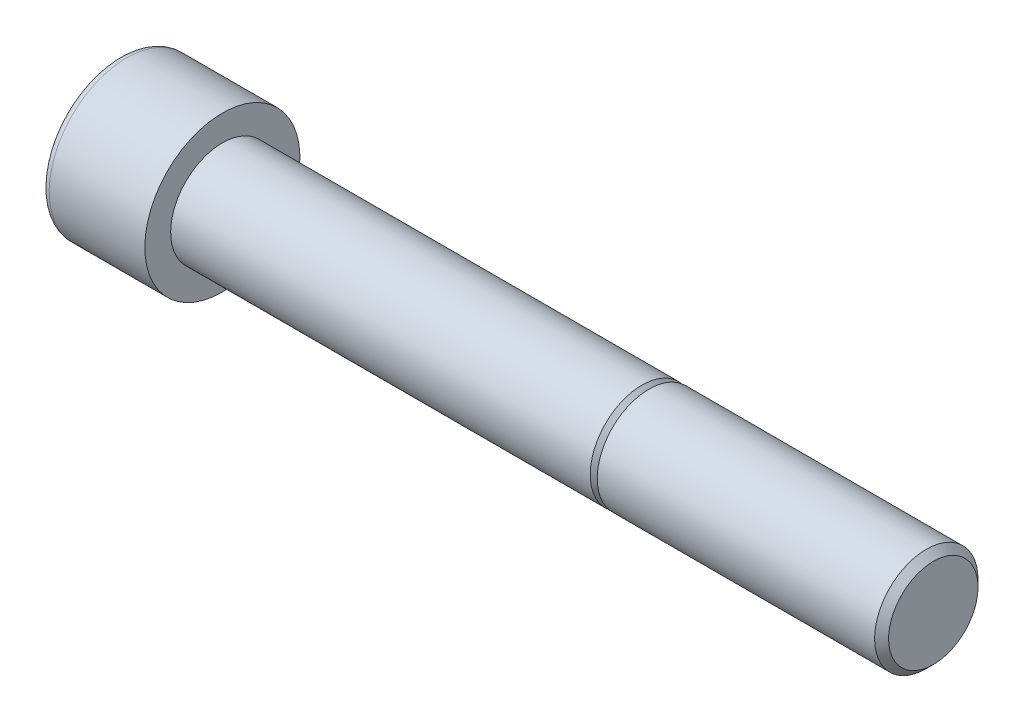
SolidWorks part; units mm, degrees
ref_plane "Plan de face" through (0, 0, 0) normal (0, 0, 1) x (1, 0, 0)
ref_plane "Plan de dessus" through (0, 0, 0) normal (0, 1, 0) x (1, 0, 0)
ref_plane "Plan de droite" through (0, 0, 0) normal (1, 0, 0) x (0, 0, -1)
ref_plane "Plan1" through (0, 0, 0) normal (0, 0, -1) x (-1, 0, 0)
sketch "Esquisse1" plane through (0, 0, 0) normal (0, 0, -1) x (-1, 0, 0)
  line L0 (-80, 8) -> (-80, 0)
  line L1 (-80, 0) -> (46, 0)
  line L2 (46, 0) -> (46, 12)
  line L3 (46, 12) -> (30, 12)
  line L4 (30, 12) -> (30, 8)
  line L5 (30, 8) -> (-34.9175, 8)
  line L6 (-34.9175, 8) -> (-36, 6.9175)
  line L7 (-36, 6.9175) -> (-36, 8)
  line L8 (-36, 8) -> (-80, 8)
  line L9 (-80, 0) -> (46, 0) construction
  dimension "D1" = 16
  dimension "D2" = 44
  dimension "D3" = 135
  dimension "D4" = 110
revolve "Révolution1" add sketch "Esquisse1" angle 360 about L9
sketch "Esquisse2" plane through (-46, 0, 0) normal (-1, 0, 0) x (0, 0, 1)
  line L0 (-7, -4.0415) -> (0, -8.0829)
  line L1 (0, -8.0829) -> (7, -4.0415)
  line L2 (7, -4.0415) -> (7, 4.0415)
  line L3 (7, 4.0415) -> (0, 8.0829)
  line L4 (0, 8.0829) -> (-7, 4.0415)
  line L5 (-7, 4.0415) -> (-7, -4.0415)
extrude "Enlèv. mat.-Extru.1" cut sketch "Esquisse2" against normal blind 8
chamfer "Chanfrein1" distance 1.0825 angle 45 1 edges at (80, -8, 0)
fillet "Congé1" radius 1.2 1 edges at (-46, -12, 0)
